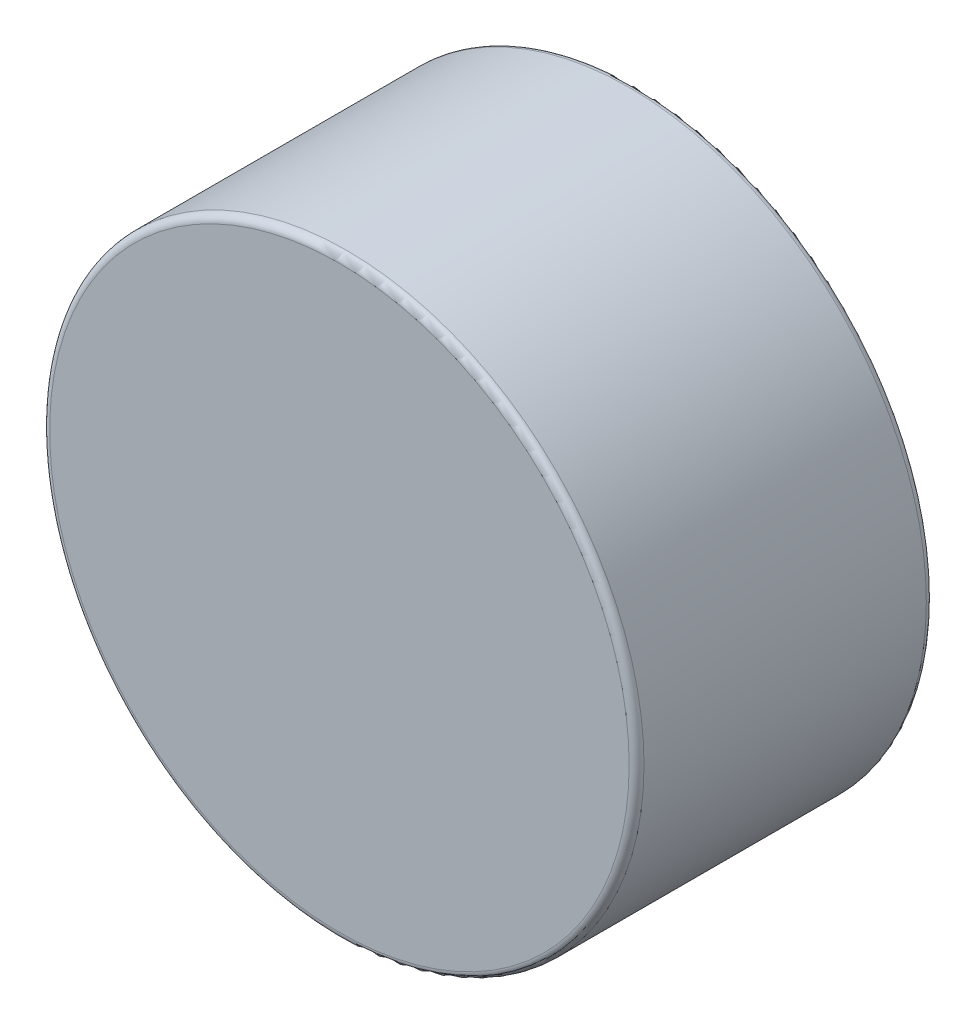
SolidWorks part; units mm, degrees
ref_plane "Plan1" through (0, 0, 0) normal (0, 0, 1) x (1, 0, 0)
ref_plane "Plan2" through (0, 0, 0) normal (0, 1, 0) x (1, 0, 0)
ref_plane "Plan3" through (0, 0, 0) normal (1, 0, 0) x (0, 0, -1)
sketch "Esquisse1" plane through (0, 0, 0) normal (0, 0, 1) x (1, 0, 0)
  circle A0 centre (0, 0) radius 4
  dimension "D1" = 8
extrude "Base-Extrusion" add sketch "Esquisse1" along normal blind 4
fillet "Congé1" radius 0.1
